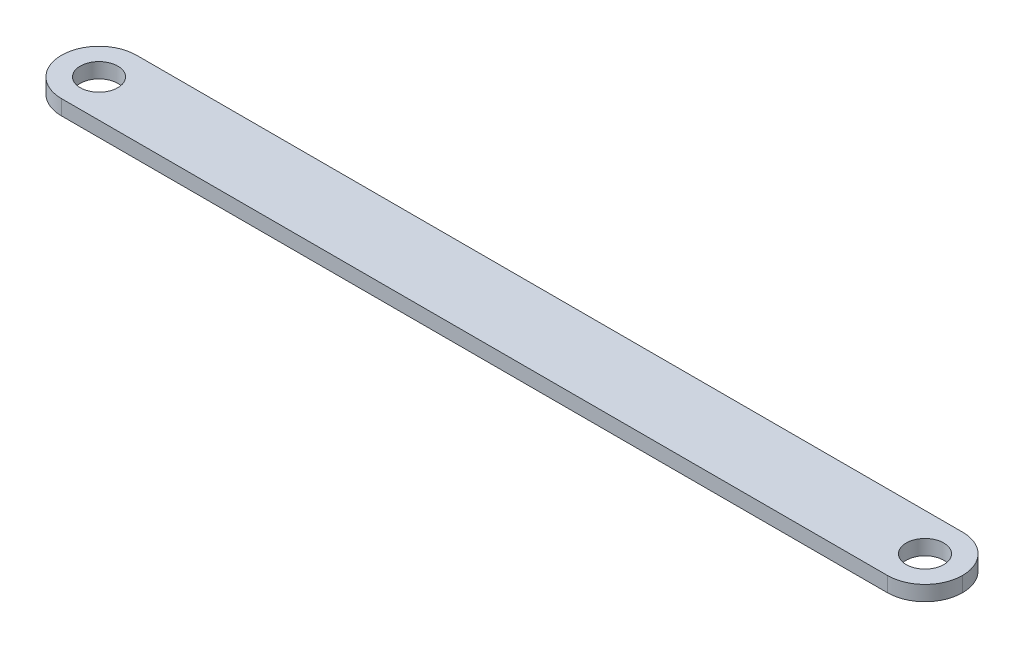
SolidWorks part; units mm, degrees
ref_plane "Front Plane" through (0, 0, 0) normal (0, 0, 1) x (1, 0, 0)
ref_plane "Top Plane" through (0, 0, 0) normal (0, 1, 0) x (1, 0, 0)
ref_plane "Right Plane" through (0, 0, 0) normal (1, 0, 0) x (0, 0, -1)
sketch "Sketch1" plane through (0, 0, 0) normal (0, 1, 0) x (1, 0, 0)
  line L1 (0, 0) -> (152.4, 0)
  line L2 (0, 0) -> (0, -12.7)
  line L3 (0, -12.7) -> (152.4, -12.7)
  line L4 (152.4, 0) -> (152.4, -12.7)
  dimension "D1" = 152.4
  dimension "D2" = 12.7
extrude "Boss-Extrude1" add sketch "Sketch1" along normal blind 2.54
fillet "Fillet1" radius 6.35 4 edges at (0, 1.27, 12.7) (0, 1.27, 0) (152.4, 1.27, 0) (152.4, 1.27, 12.7)
sketch "Sketch2" plane through (0, 2.54, 0) normal (0, 1, 0) x (1, 0, 0)
  line L0 (6.35, -12.7) -> (146.05, -12.7) construction
  circle A0 centre (146.05, -6.35) radius 3.175
  circle A1 centre (6.35, -6.35) radius 3.175
  dimension "D1" = 6.35
  dimension "D4" = 6.35
  dimension "D2" = 6.35
  dimension "D3" = 6.35
  dimension "D5" = 6.35
  dimension "D6" = 6.35
extrude "Cut-Extrude1" cut sketch "Sketch2" against normal blind 2.54
